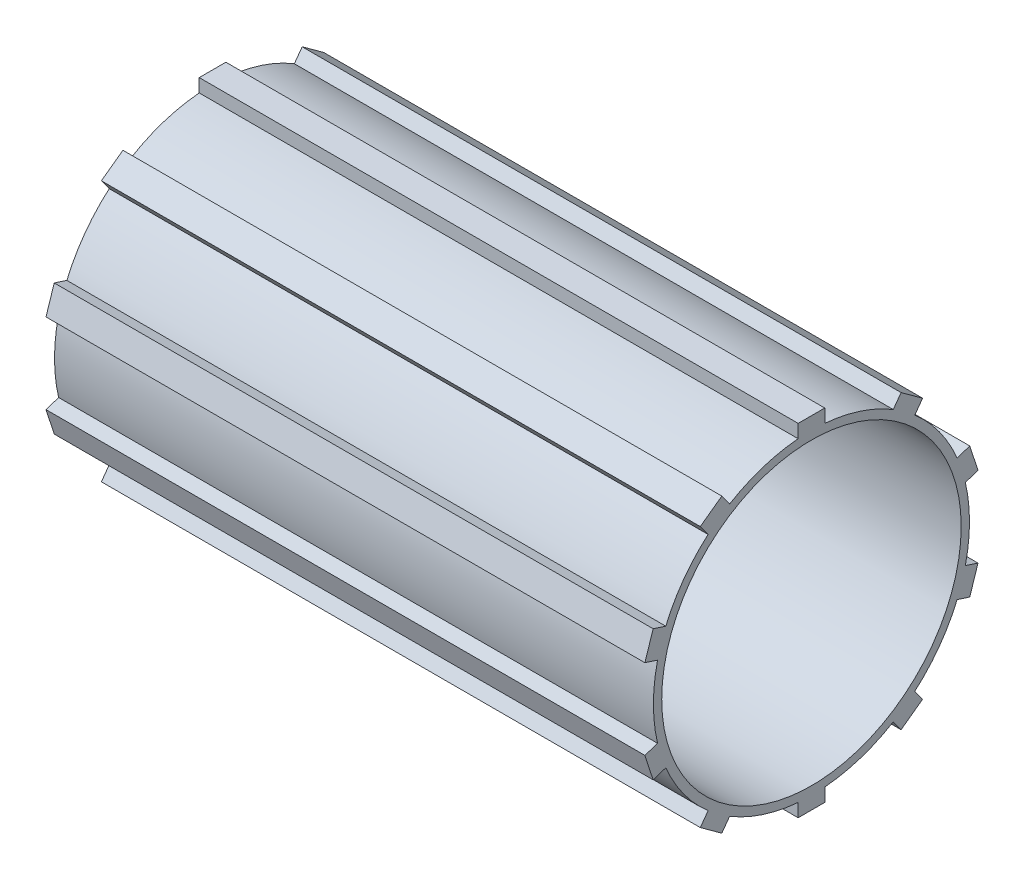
SolidWorks part; units mm, degrees
ref_plane "Plan de face" through (0, 0, 0) normal (0, 0, 1) x (1, 0, 0)
ref_plane "Plan de dessus" through (0, 0, 0) normal (0, 1, 0) x (1, 0, 0)
ref_plane "Plan de droite" through (0, 0, 0) normal (1, 0, 0) x (0, 0, -1)
sketch "Esquisse2" plane through (0, 0, 0) normal (1, 0, 0) x (0, 0, -1)
  circle A0 centre (0, 0) radius 23.75
  circle A1 centre (0, 0) radius 22.5
  dimension "D1" = 47.5
  dimension "D2" = 45
extrude "Boss.-Extru.1" add sketch "Esquisse2" along normal blind 90
sketch "Esquisse4" plane through (0, 0, 0) normal (1, 0, 0) x (0, 0, -1)
  line L5 (-2, 25.6656) -> (2, 25.6656)
  line L6 (-2, 25.6656) -> (-2, 23.6656)
  line L7 (-2, 23.6656) -> (2, 23.6656)
  line L8 (2, 25.6656) -> (2, 23.6656)
  line L9 (-2, 25.6656) -> (2, 23.6656) construction
  line L10 (-2, 23.6656) -> (2, 25.6656) construction
  circle A0 centre (0, 0) radius 23.75 construction
  point P0 (0, 24.6656)
  dimension "D1" = 4
  dimension "D2" = 0
  dimension "D3" = 2
extrude "Boss.-Extru.2" add sketch "Esquisse4" along normal blind 90 contours L5 L8 L7 L6
pattern_circular "Répétition circulaire1" count 10 every 36 about axis through (0, 0, 0) along (1, 0, 0) of "Boss.-Extru.2"
